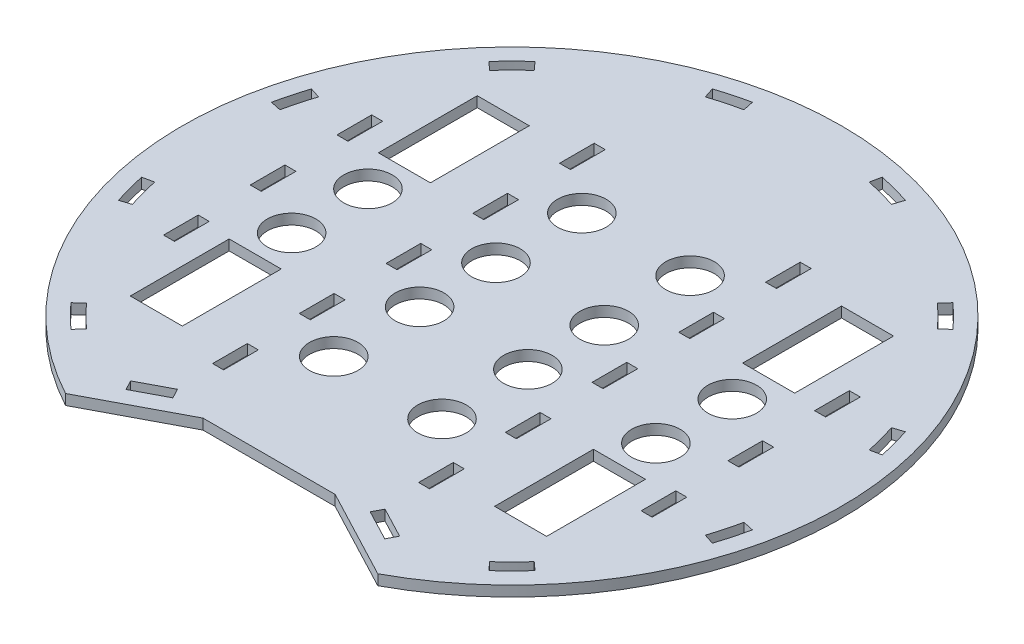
SolidWorks part; units mm, degrees
ref_plane "Front Plane" through (0, 0, 0) normal (0, 0, 1) x (1, 0, 0)
ref_plane "Top Plane" through (0, 0, 0) normal (0, 1, 0) x (1, 0, 0)
ref_plane "Right Plane" through (0, 0, 0) normal (1, 0, 0) x (0, 0, -1)
sketch "Sketch1" plane through (0, 0, 0) normal (0, 1, 0) x (1, 0, 0)
  line L0 (-106.3364, -157.4566) -> (-42.1421, -123.65) construction
  line L1 (-120, -100.0099) -> (-90, -100.0099)
  line L2 (-120, -100.0099) -> (-120, -43.0099)
  line L3 (-120, -43.0099) -> (-90, -43.0099)
  line L4 (-90, -100.0099) -> (-90, -43.0099)
  line L5 (-120, 43.0099) -> (-90, 43.0099)
  line L6 (-120, 43.0099) -> (-120, 100.0099)
  line L7 (-120, 100.0099) -> (-90, 100.0099)
  line L8 (-90, 43.0099) -> (-90, 100.0099)
  line L9 (90, 100.0099) -> (120, 100.0099)
  line L10 (90, 100.0099) -> (90, 43.0099)
  line L11 (90, 43.0099) -> (120, 43.0099)
  line L12 (120, 100.0099) -> (120, 43.0099)
  line L13 (120, -43.0099) -> (90, -43.0099)
  line L14 (120, -43.0099) -> (120, -100.0099)
  line L15 (120, -100.0099) -> (90, -100.0099)
  line L16 (90, -43.0099) -> (90, -100.0099)
  line L17 (-42.1421, -123.65) -> (42.1421, -123.65) construction
  line L18 (0, 190) -> (0, -190) construction
  line L19 (-105, 43.0099) -> (-105, -43.0099) construction
  line L20 (-190, 0) -> (190, 0) construction
  line L33 (140.85, -40) -> (140.85, -60)
  line L34 (-134.5, 40) -> (-140.85, 40)
  line L35 (-134.5, 40) -> (-134.5, 60)
  line L36 (-134.5, 60) -> (-140.85, 60)
  line L37 (-140.85, 40) -> (-140.85, 60)
  line L38 (-134.5, 10) -> (-140.85, 10)
  line L39 (-134.5, 10) -> (-134.5, -10)
  line L40 (-134.5, -10) -> (-140.85, -10)
  line L41 (-140.85, 10) -> (-140.85, -10)
  line L46 (-134.5, -40) -> (-140.85, -40)
  line L47 (-134.5, -40) -> (-134.5, -60)
  line L48 (-134.5, -60) -> (-140.85, -60)
  line L49 (-140.85, -40) -> (-140.85, -60)
  line L50 (134.5, -60) -> (140.85, -60)
  line L51 (134.5, -40) -> (134.5, -60)
  line L52 (134.5, -40) -> (140.85, -40)
  line L53 (140.85, 10) -> (140.85, -10)
  line L54 (134.5, -10) -> (140.85, -10)
  line L55 (134.5, 10) -> (134.5, -10)
  line L56 (134.5, 10) -> (140.85, 10)
  line L57 (140.85, 40) -> (140.85, 60)
  line L58 (134.5, 60) -> (140.85, 60)
  line L59 (134.5, 40) -> (134.5, 60)
  line L60 (134.5, 40) -> (140.85, 40)
  line L73 (42.1421, -123.65) -> (106.3364, -157.4566) construction
  line L86 (0, 0) -> (-37.4241, 176.0666) construction
  line L99 (-155.3051, -190) -> (147.1552, -190) construction
  line L100 (-128.4523, -140) -> (128.4523, -140) construction
  line L101 (-90, -167.332) -> (-38.1, -140)
  line L102 (-38.1, -140) -> (38.1, -140)
  line L103 (38.1, -140) -> (90, -167.332)
  line L104 (-53.6608, 165.151) -> (-55.6231, 171.1902)
  line L105 (0, 0) -> (-55.6231, 171.1902) construction
  line L126 (105, 43.0099) -> (105, -43.0099) construction
  line L127 (-37.4241, 176.0666) -> (-36.1039, 169.8553)
  line L128 (-100.2255, -161.4151) -> (-40.5722, -130) construction
  line L129 (-120.4435, 133.7661) -> (-116.1945, 129.0471)
  line L130 (-40.5722, -130) -> (40.5722, -130) construction
  line L131 (40.5722, -130) -> (100.2255, -161.4151) construction
  line L132 (-129.0471, 116.1945) -> (-133.7661, 120.4435)
  line L133 (-171.1902, 55.6231) -> (-165.151, 53.6608)
  line L134 (-169.8553, 36.1039) -> (-176.0666, 37.4241)
  line L135 (-176.0666, -37.4241) -> (-169.8553, -36.1039)
  line L136 (-165.151, -53.6608) -> (-171.1902, -55.6231)
  line L137 (-133.7661, -120.4435) -> (-129.0471, -116.1945)
  line L138 (-116.1945, -129.0471) -> (-120.4435, -133.7661)
  line L139 (0, 0) -> (-36.1039, 169.8553) construction
  line L140 (56.2033, -10) -> (62.5533, -10)
  line L141 (116.1945, -129.0471) -> (120.4435, -133.7661)
  line L142 (133.7661, -120.4435) -> (129.0471, -116.1945)
  line L143 (165.151, -53.6608) -> (171.1902, -55.6231)
  line L144 (176.0666, -37.4241) -> (169.8553, -36.1039)
  line L145 (169.8553, 36.1039) -> (176.0666, 37.4241)
  line L146 (171.1902, 55.6231) -> (165.151, 53.6608)
  line L147 (129.0471, 116.1945) -> (133.7661, 120.4435)
  line L148 (120.4435, 133.7661) -> (116.1945, 129.0471)
  line L149 (37.4241, 176.0666) -> (36.1039, 169.8553)
  line L150 (53.6608, 165.151) -> (55.6231, 171.1902)
  line L151 (-56.8793, -138.5878) -> (-59.8381, -132.9693)
  line L152 (-59.8381, -132.9693) -> (-77.5342, -142.2885)
  line L153 (-77.5342, -142.2885) -> (-74.5754, -147.907)
  line L154 (-74.5754, -147.907) -> (-56.8793, -138.5878)
  line L155 (77.5342, -142.2885) -> (74.5754, -147.907)
  line L156 (74.5754, -147.907) -> (56.8793, -138.5878)
  line L157 (56.8793, -138.5878) -> (59.8381, -132.9693)
  line L158 (59.8381, -132.9693) -> (77.5342, -142.2885)
  line L159 (-62.5533, 40) -> (-56.2033, 40)
  line L164 (-56.2033, 10) -> (-62.5533, 10)
  line L165 (-56.2033, 10) -> (-56.2033, -10)
  line L166 (-56.2033, -10) -> (-62.5533, -10)
  line L167 (-62.5533, 10) -> (-62.5533, -10)
  line L168 (-62.5533, 40) -> (-62.5533, 60)
  line L169 (-62.5533, 60) -> (-56.2033, 60)
  line L170 (-56.2033, 40) -> (-56.2033, 60)
  line L171 (-62.5533, 90) -> (-56.2033, 90)
  line L172 (-62.5533, 90) -> (-62.5533, 110)
  line L173 (-62.5533, 110) -> (-56.2033, 110)
  line L174 (-56.2033, 90) -> (-56.2033, 110)
  line L175 (-62.5533, -40) -> (-56.2033, -40)
  line L176 (-62.5533, -40) -> (-62.5533, -60)
  line L177 (-62.5533, -60) -> (-56.2033, -60)
  line L178 (-56.2033, -40) -> (-56.2033, -60)
  line L179 (-62.5533, -90) -> (-56.2033, -90)
  line L180 (-62.5533, -90) -> (-62.5533, -110)
  line L181 (-62.5533, -110) -> (-56.2033, -110)
  line L182 (-56.2033, -90) -> (-56.2033, -110)
  line L183 (62.5533, -60) -> (56.2033, -60)
  line L184 (56.2033, -40) -> (56.2033, -60)
  line L185 (62.5533, -40) -> (62.5533, -60)
  line L186 (62.5533, -40) -> (56.2033, -40)
  line L187 (62.5533, -110) -> (56.2033, -110)
  line L188 (62.5533, -90) -> (56.2033, -90)
  line L189 (56.2033, -90) -> (56.2033, -110)
  line L190 (62.5533, -90) -> (62.5533, -110)
  line L191 (56.2033, 90) -> (56.2033, 110)
  line L192 (62.5533, 110) -> (56.2033, 110)
  line L193 (62.5533, 90) -> (62.5533, 110)
  line L194 (62.5533, 90) -> (56.2033, 90)
  line L195 (56.2033, 40) -> (56.2033, 60)
  line L196 (62.5533, 60) -> (56.2033, 60)
  line L197 (62.5533, 40) -> (62.5533, 60)
  line L198 (62.5533, 10) -> (62.5533, -10)
  line L199 (56.2033, 10) -> (56.2033, -10)
  line L200 (56.2033, 10) -> (62.5533, 10)
  line L201 (62.5533, 40) -> (56.2033, 40)
  line L202 (-134.5, -60) -> (-134.5, -109.8366) construction
  line L203 (-134.5, 60) -> (-134.5, 109.8366) construction
  line L204 (-56.2033, 110) -> (-56.2033, 164.3031) construction
  line L205 (-56.2033, -110) -> (-56.2033, -131.0551) construction
  circle A0 centre (0, 0) radius 190 construction
  arc A3 (-90, -167.332) -> (90, -167.332) centre (0, 0) cw
  circle A4 centre (-105, -22.0099) radius 13.9895
  circle A5 centre (-105, 22.0099) radius 13.9895
  circle A6 centre (105, 22.0099) radius 13.9895
  circle A7 centre (105, -22.0099) radius 13.9895
  circle A16 centre (0, 0) radius 180 construction
  circle A17 centre (0, 0) radius 173.65 construction
  arc A18 (-55.6231, 171.1902) -> (-37.4241, 176.0666) centre (0, 0) cw
  arc A19 (-53.6608, 165.151) -> (-36.1039, 169.8553) centre (0, 0) cw
  arc A20 (-133.7661, 120.4435) -> (-120.4435, 133.7661) centre (0, 0) cw
  arc A21 (-129.0471, 116.1945) -> (-116.1945, 129.0471) centre (0, 0) cw
  arc A22 (-176.0666, 37.4241) -> (-171.1902, 55.6231) centre (0, 0) cw
  arc A23 (-169.8553, 36.1039) -> (-165.151, 53.6608) centre (0, 0) cw
  arc A24 (-171.1902, -55.6231) -> (-176.0666, -37.4241) centre (0, 0) cw
  arc A25 (-165.151, -53.6608) -> (-169.8553, -36.1039) centre (0, 0) cw
  arc A26 (-120.4435, -133.7661) -> (-133.7661, -120.4435) centre (0, 0) cw
  arc A27 (-116.1945, -129.0471) -> (-129.0471, -116.1945) centre (0, 0) cw
  arc A28 (120.4435, -133.7661) -> (133.7661, -120.4435) centre (0, 0) ccw
  arc A29 (116.1945, -129.0471) -> (129.0471, -116.1945) centre (0, 0) ccw
  arc A30 (165.151, -53.6608) -> (169.8553, -36.1039) centre (0, 0) ccw
  arc A31 (171.1902, -55.6231) -> (176.0666, -37.4241) centre (0, 0) ccw
  arc A32 (176.0666, 37.4241) -> (171.1902, 55.6231) centre (0, 0) ccw
  arc A33 (169.8553, 36.1039) -> (165.151, 53.6608) centre (0, 0) ccw
  arc A34 (133.7661, 120.4435) -> (120.4435, 133.7661) centre (0, 0) ccw
  arc A35 (129.0471, 116.1945) -> (116.1945, 129.0471) centre (0, 0) ccw
  arc A36 (53.6608, 165.151) -> (36.1039, 169.8553) centre (0, 0) ccw
  arc A37 (55.6231, 171.1902) -> (37.4241, 176.0666) centre (0, 0) ccw
  circle A38 centre (-31.2033, 22.0099) radius 13.9895
  circle A39 centre (-31.2033, 71.5099) radius 13.9895
  circle A40 centre (-31.2033, -22.0099) radius 13.9895
  circle A41 centre (-31.2033, -71.5099) radius 13.9895
  circle A42 centre (31.2033, -71.5099) radius 13.9895
  circle A43 centre (31.2033, -22.0099) radius 13.9895
  circle A44 centre (31.2033, 71.5099) radius 13.9895
  circle A45 centre (31.2033, 22.0099) radius 13.9895
  point P71 (-59.3783, 90)
  point P116 (0, -140)
  point P166 (-90, -71.5099)
  point P168 (-90, 71.5099)
  point P199 (-56.2033, 0)
  dimension "D1" = 380
  dimension "D5" = 90
  dimension "D25" = 27.979
  dimension "D30" = 360
  dimension "D31" = 347.3
  dimension "D38" = 20
  dimension "D3" = 30
  dimension "D4" = 57
  dimension "D6" = 6.35
  dimension "D7" = 71.9467
  dimension "D8" = 20
  dimension "D9" = 30
  dimension "D10" = 30
  dimension "D11" = 30
  dimension "D12" = 14.5
  dimension "D13" = 200.0199
  dimension "D14" = 100.0099
  dimension "D15" = 90
  dimension "D16" = 6.35
  dimension "D17" = 50
  dimension "D18" = 76.2
  dimension "D19" = 6.35
  dimension "D20" = 6.35
  dimension "D21" = 30
  dimension "D22" = 30
  dimension "D23" = 54.3031
  dimension "D24" = 49.8366
  dimension "D26" = 21
  dimension "D27" = 21
  dimension "D28" = 6
  dimension "D29" = 12
  dimension "D32" = 10
  dimension "D33" = 10
  dimension "D34" = 10
  dimension "D35" = 5
  dimension "D36" = 49.8366
  dimension "D37" = 21.0551
  dimension "D39" = 20
  dimension "D41" = 20
extrude "Boss-Extrude1" add sketch "Sketch1" along normal blind 6
